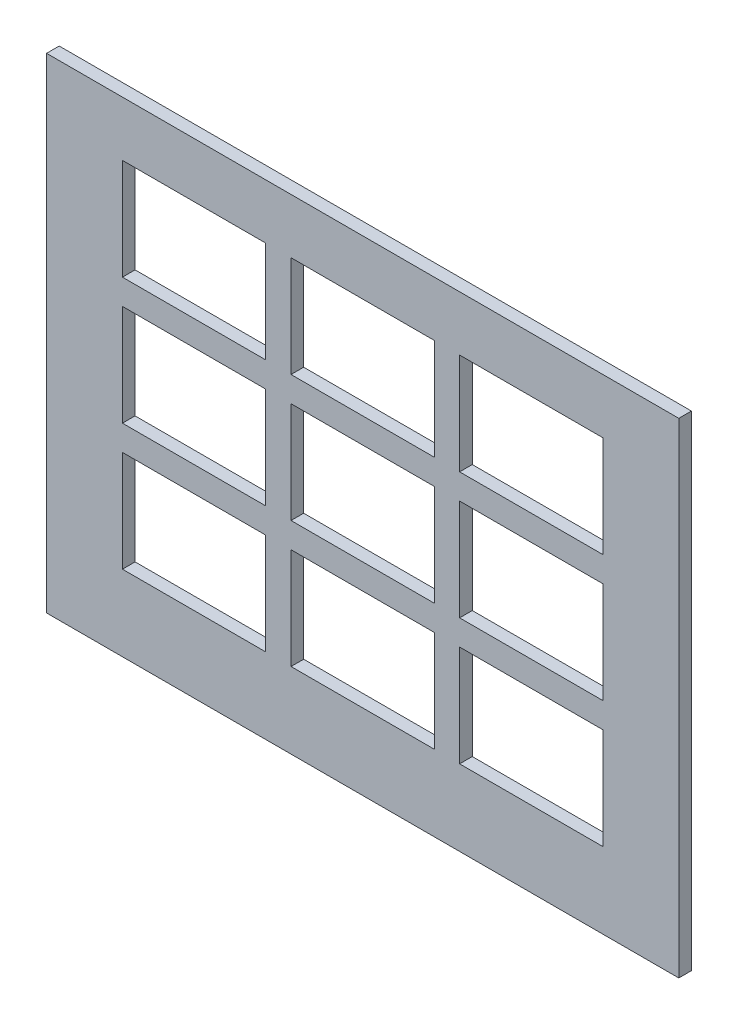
SolidWorks part; units mm, degrees
ref_plane "Plan de face" through (0, 0, 0) normal (0, 0, 1) x (1, 0, 0)
ref_plane "Plan de dessus" through (0, 0, 0) normal (0, 1, 0) x (1, 0, 0)
ref_plane "Plan de droite" through (0, 0, 0) normal (1, 0, 0) x (0, 0, -1)
sketch "Esquisse1" plane through (0, 0, 0) normal (0, 0, 1) x (1, 0, 0)
  line L0 (170, 15) -> (-10, 15) construction
  line L1 (0, 0) -> (150, 0)
  line L2 (0, 0) -> (0, 115)
  line L3 (0, 115) -> (150, 115)
  line L4 (150, 0) -> (150, 115)
  line L5 (-10, 105) -> (170, 105) construction
  line L6 (-10, 75) -> (170, 75) construction
  line L7 (-10, 45) -> (170, 45) construction
  line L8 (135, 120) -> (135, -10) construction
  line L9 (15, 120) -> (15, -10) construction
  line L10 (95, 120) -> (95, -20) construction
  line L11 (55, 120) -> (55, -10) construction
  line L12 (132, 48) -> (132, 72)
  line L13 (98, 102) -> (132, 102)
  line L14 (98, 102) -> (98, 78)
  line L15 (98, 78) -> (132, 78)
  line L16 (132, 102) -> (132, 78)
  line L17 (98, 72) -> (132, 72)
  line L18 (98, 48) -> (98, 72)
  line L19 (98, 48) -> (132, 48)
  line L20 (98, 18) -> (132, 18)
  line L21 (132, 42) -> (132, 18)
  line L22 (98, 42) -> (98, 18)
  line L23 (98, 42) -> (132, 42)
  line L24 (92, 42) -> (92, 18)
  line L25 (92, 18) -> (58, 18)
  line L26 (58, 42) -> (58, 18)
  line L27 (92, 42) -> (58, 42)
  line L28 (58, 48) -> (58, 72)
  line L29 (92, 48) -> (58, 48)
  line L30 (92, 48) -> (92, 72)
  line L31 (92, 72) -> (58, 72)
  line L32 (58, 102) -> (58, 78)
  line L33 (92, 78) -> (58, 78)
  line L34 (92, 102) -> (92, 78)
  line L35 (92, 102) -> (58, 102)
  line L36 (18, 42) -> (18, 18)
  line L37 (18, 18) -> (52, 18)
  line L38 (52, 42) -> (52, 18)
  line L39 (18, 42) -> (52, 42)
  line L40 (18, 48) -> (18, 72)
  line L41 (18, 48) -> (52, 48)
  line L42 (52, 48) -> (52, 72)
  line L43 (18, 72) -> (52, 72)
  line L44 (18, 102) -> (18, 78)
  line L45 (18, 78) -> (52, 78)
  line L46 (52, 102) -> (52, 78)
  line L47 (18, 102) -> (52, 102)
  dimension "D1" = 150
  dimension "D2" = 115
  dimension "D3" = 15
  dimension "D4" = 90
  dimension "D5" = 30
  dimension "D6" = 30
  dimension "D7" = 15
  dimension "D8" = 120
  dimension "D9" = 40
  dimension "D10" = 40
  dimension "D11" = 3
  dimension "D12" = 3
  dimension "D13" = 3
  dimension "D14" = 3
extrude "Extrusion1" add sketch "Esquisse1" along normal blind 3
